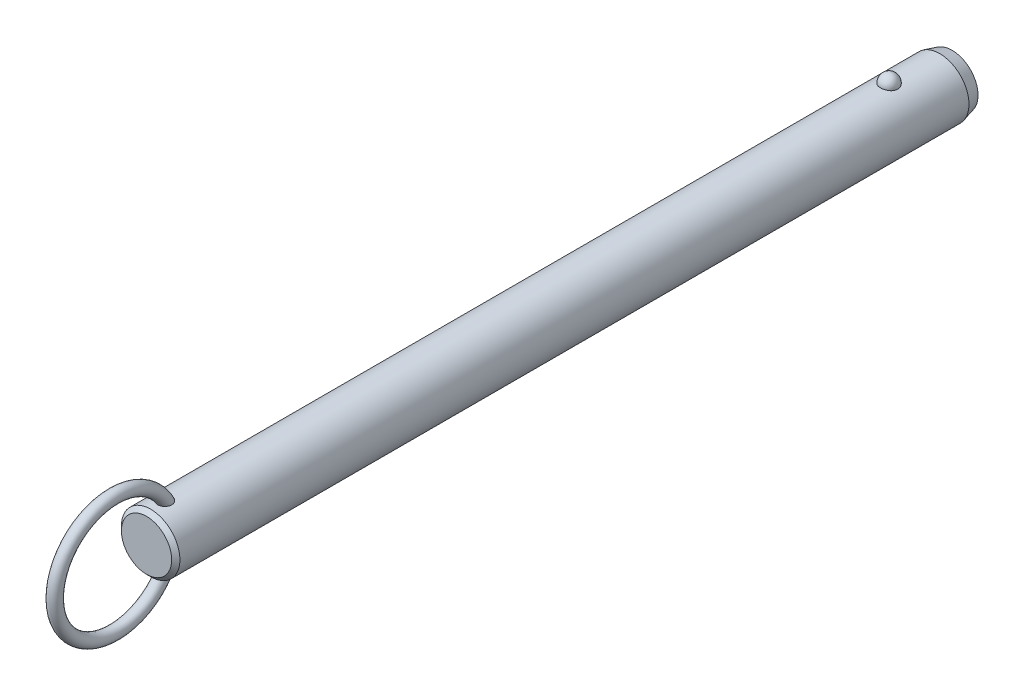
SolidWorks part; units mm, degrees
ref_plane "Front Plane" through (0, 0, 0) normal (0, 0, 1) x (1, 0, 0)
ref_plane "Top Plane" through (0, 0, 0) normal (0, 1, 0) x (1, 0, 0)
ref_plane "Right Plane" through (0, 0, 0) normal (1, 0, 0) x (0, 0, -1)
sketch "Sketch2" plane through (0, 0, 0) normal (0, 0, 1) x (1, 0, 0)
  circle A0 centre (0, 0) radius 7.1
  point P3 (0, 7.1)
  dimension "D1" = 14.2
extrude "Boss-Extrude1" add sketch "Sketch2" along normal blind 170.2
sketch "Sketch3" plane through (0, 0, 0) normal (0, 0, -1) x (-1, 0, 0)
  circle A0 centre (0, 0) radius 7.1
  dimension "D1" = 14.2
extrude "Boss-Extrude2" add sketch "Sketch3" along normal blind 17.4
chamfer "Chamfer1" distance 3 angle 15 1 edges at (-7.1, 0, -17.4)
sketch "Sketch12" plane through (0, 0, 0) normal (1, 0, 0) x (0, 0, -1)
  line L0 (-170.2, 7.1) -> (-170.2, -7.1) construction
  point P0 (-170.2, 0)
sketch "Sketch13" plane through (0, 0, 0) normal (1, 0, 0) x (0, 0, -1)
  circle A0 centre (-186.05, 0) radius 15.85
  point P2 (-170.2, 0)
  dimension "D1" = 31.7
sketch "Sketch14" plane through (0, 0, 0) normal (0, 1, 0) x (1, 0, 0)
  circle A0 centre (0, -171.7) radius 1.5
  point P2 (0, -170.2)
  dimension "D1" = 3
sweep "Sweep1" add profiles "Sketch14" path "Sketch13"
sketch "Sketch15" plane through (0, 0, 170.2) normal (0, 0, 1) x (1, 0, 0)
  circle A0 centre (0, 0) radius 7.1
  dimension "D1" = 14.2
extrude "Boss-Extrude3" add sketch "Sketch15" along normal blind 7.92
chamfer "Chamfer2" distance 1 angle 45 1 edges at (7.1, 0, 178.12)
sketch "Sketch18" plane through (0, 0, 0) normal (1, 0, 0) x (0, 0, -1)
  line L0 (14.4, 7.1) -> (-171.8792, 7.1) construction
  line L1 (2.1, 9.2) -> (2.1, 5)
  line L2 (-171.8792, -7.1) -> (14.4, -7.1) construction
  arc A0 (2.1, 9.2) -> (2.1, 5) centre (2.1, 7.1) ccw
  point P4 (0, 7.1)
  dimension "D1" = 16.3
revolve "Revolve1" add sketch "Sketch18" angle 360 about L1
